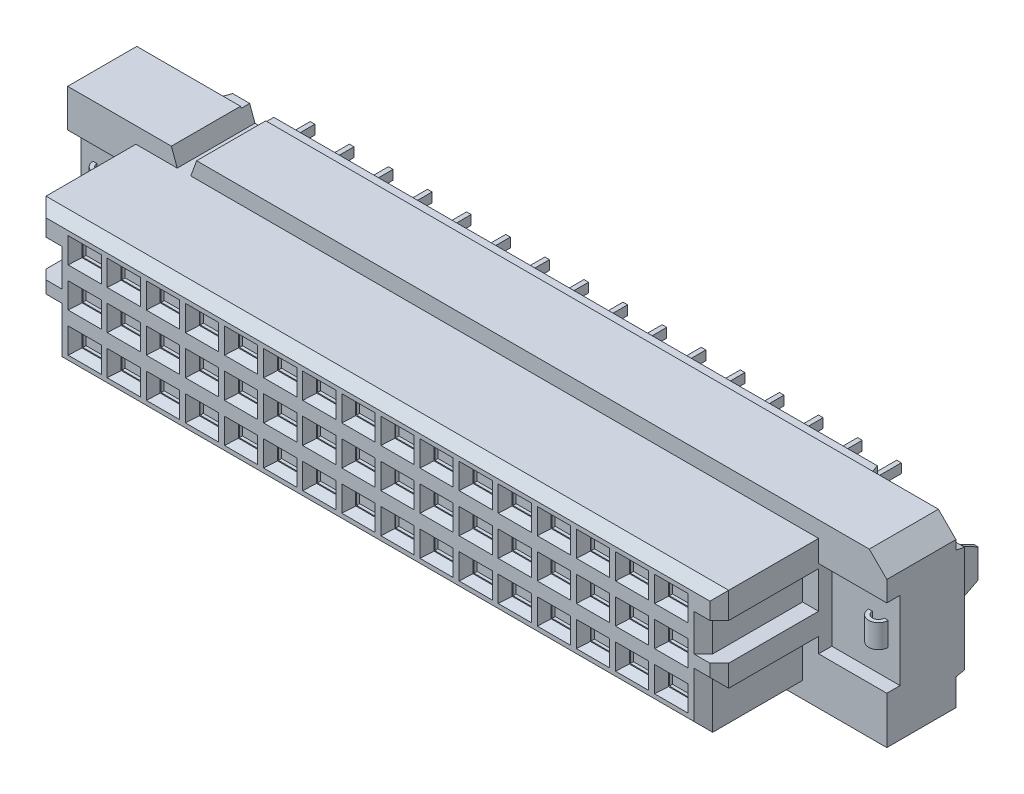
SolidWorks part; units mm, degrees
ref_plane "Front Plane" through (0, 0, 0) normal (0, 0, 1) x (1, 0, 0)
ref_plane "Top Plane" through (0, 0, 0) normal (0, 1, 0) x (1, 0, 0)
ref_plane "Right Plane" through (0, 0, 0) normal (1, 0, 0) x (0, 0, -1)
imported_body "Imported1"
sketch "Sketch3" plane through (0, 0, -10.94) normal (0, 0, -1) x (-1, 0, 0)
  line L1 (18.9, -2.235) -> (19.2, -2.235)
  line L2 (18.9, -2.235) -> (18.9, -2.845)
  line L3 (18.9, -2.845) -> (19.2, -2.845)
  line L4 (19.2, -2.235) -> (19.2, -2.845)
extrude "Boss-Extrude2" add sketch "Sketch3" along normal blind 5.08
ref_plane "Plane1" through (0, 2.54, 0) normal (0, 1, 0) x (1, 0, 0)
